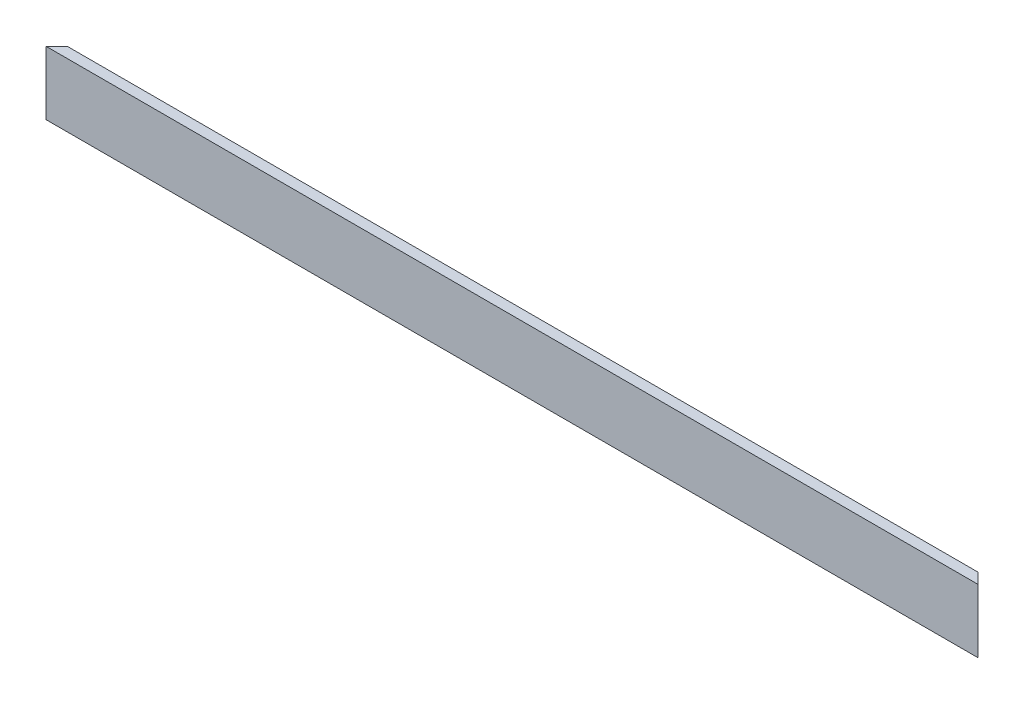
SolidWorks part; units mm, degrees
ref_plane "Front Plane" through (0, 0, 0) normal (0, 0, 1) x (1, 0, 0)
ref_plane "Top Plane" through (0, 0, 0) normal (0, 1, 0) x (1, 0, 0)
ref_plane "Right Plane" through (0, 0, 0) normal (1, 0, 0) x (0, 0, -1)
sketch "Sketch1" plane through (0, 0, 0) normal (1, 0, 0) x (0, 0, -1)
  line L0 (0, 0) -> (0, 38.1)
  line L1 (0, 38.1) -> (6.35, 38.1)
  line L2 (6.35, 38.1) -> (6.35, 6.35)
  line L3 (0, 0) -> (38.1, 0)
  line L4 (38.1, 0) -> (38.1, 6.35)
  line L5 (38.1, 6.35) -> (6.35, 6.35)
  dimension "D1" = 38.1
  dimension "D2" = 38.1
  dimension "D3" = 6.35
  dimension "D4" = 6.35
extrude "Boss-Extrude1" add sketch "Sketch1" along normal blind 558.8
sketch "Sketch2" plane through (0, 0, 0) normal (0, 1, 0) x (1, 0, 0)
  line L0 (0, 0) -> (38.1, 38.1)
  line L1 (558.8, 38.1) -> (0, 38.1) construction
  line L2 (38.1, 38.1) -> (0, 38.1)
  line L3 (0, 38.1) -> (0, 6.35) construction
  line L4 (0, 38.1) -> (0, 0)
  line L5 (558.8, 0) -> (520.7, 38.1)
  line L6 (520.7, 38.1) -> (558.8, 38.1)
  line L7 (558.8, 38.1) -> (558.8, 0)
extrude "Cut-Extrude3" cut sketch "Sketch2" along normal through all
